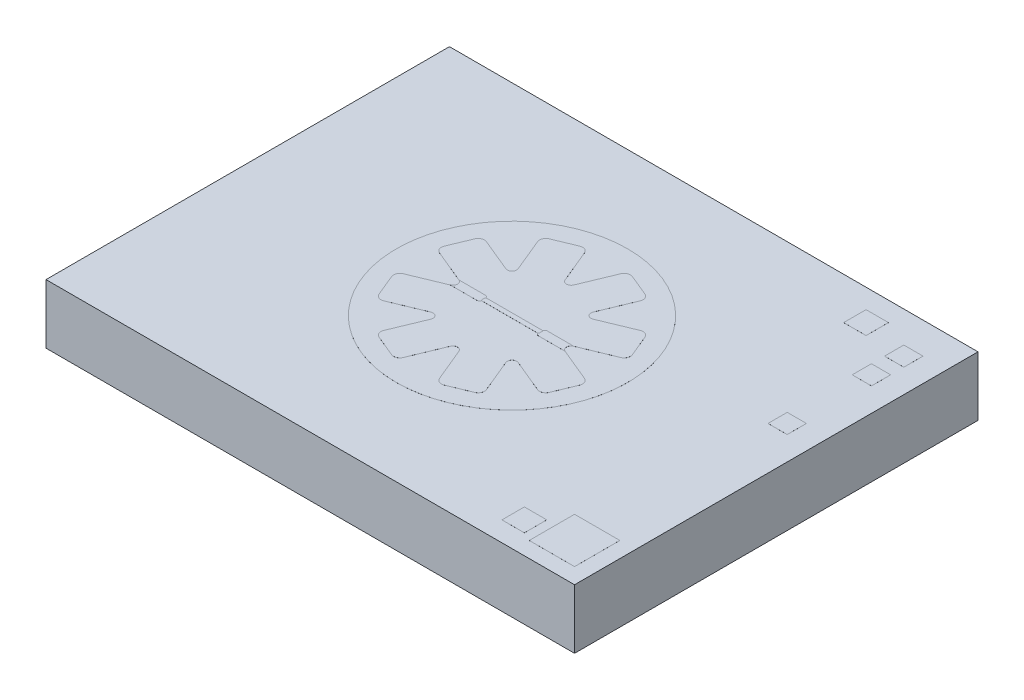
SolidWorks part; units mm, degrees
ref_plane "Front Plane" through (0, 0, 0) normal (0, 0, 1) x (1, 0, 0)
ref_plane "Top Plane" through (0, 0, 0) normal (0, 1, 0) x (1, 0, 0)
ref_plane "Right Plane" through (0, 0, 0) normal (1, 0, 0) x (0, 0, -1)
sketch "Sketch1" plane through (0, 0, 0) normal (0, 1, 0) x (1, 0, 0)
  line L1 (0, 0) -> (4.2926, 0)
  line L2 (0, 0) -> (0, 3.2766)
  line L3 (0, 3.2766) -> (4.2926, 3.2766)
  line L4 (4.2926, 0) -> (4.2926, 3.2766)
  dimension "D1" = 4.2926
  dimension "D2" = 3.2766
extrude "die" add sketch "Sketch1" along normal blind 0.4826
sketch "Sketch2" plane through (0, 0.4826, 0) normal (0, 1, 0) x (1, 0, 0)
  line L0 (0, 3.2766) -> (4.2926, 0) construction
  circle A0 centre (2.1463, 1.6383) radius 0.9398
  dimension "D1" = 1.8796
extrude "Boss-Extrude1" add sketch "Sketch2" along normal blind 0.0003
sketch "Sketch3" plane through (0, 0.4829, 0) normal (0, 1, 0) x (1, 0, 0)
  line L0 (1.7653, 1.6383) -> (1.363, 1.8049)
  line L1 (1.363, 1.8049) -> (1.4746, 2.0743)
  line L2 (1.4746, 2.0743) -> (1.8769, 1.9077)
  line L3 (1.8769, 1.9077) -> (1.7103, 2.31)
  line L4 (1.7103, 2.31) -> (1.9797, 2.4216)
  line L5 (1.9797, 2.4216) -> (2.1463, 2.0193)
  line L6 (1.4188, 1.9396) -> (2.1463, 1.6383) construction
  line L7 (1.845, 2.3658) -> (2.1463, 1.6383) construction
  line L8 (2.5273, 1.6383) -> (1.7653, 1.6383) construction
  line L9 (2.1463, 1.2573) -> (2.1463, 2.0193) construction
  line L10 (2.4476, 2.3658) -> (2.1463, 1.6383) construction
  line L11 (2.8738, 1.9396) -> (2.1463, 1.6383) construction
  line L12 (2.3129, 2.4216) -> (2.1463, 2.0193)
  line L13 (2.5823, 2.31) -> (2.3129, 2.4216)
  line L14 (2.4157, 1.9077) -> (2.5823, 2.31)
  line L15 (2.818, 2.0743) -> (2.4157, 1.9077)
  line L16 (2.9296, 1.8049) -> (2.818, 2.0743)
  line L17 (2.5273, 1.6383) -> (2.9296, 1.8049)
  line L18 (2.8738, 1.337) -> (2.1463, 1.6383) construction
  line L19 (2.4476, 0.9108) -> (2.1463, 1.6383) construction
  line L20 (1.845, 0.9108) -> (2.1463, 1.6383) construction
  line L21 (1.4188, 1.337) -> (2.1463, 1.6383) construction
  line L22 (2.5273, 1.6383) -> (2.9296, 1.4717)
  line L23 (2.9296, 1.4717) -> (2.818, 1.2023)
  line L24 (2.818, 1.2023) -> (2.4157, 1.3689)
  line L25 (2.4157, 1.3689) -> (2.5823, 0.9666)
  line L26 (2.5823, 0.9666) -> (2.3129, 0.855)
  line L27 (2.3129, 0.855) -> (2.1463, 1.2573)
  line L28 (1.9797, 0.855) -> (2.1463, 1.2573)
  line L29 (1.7103, 0.9666) -> (1.9797, 0.855)
  line L30 (1.8769, 1.3689) -> (1.7103, 0.9666)
  line L31 (1.4746, 1.2023) -> (1.8769, 1.3689)
  line L32 (1.363, 1.4717) -> (1.4746, 1.2023)
  line L33 (1.7653, 1.6383) -> (1.363, 1.4717)
  circle A0 centre (2.1463, 1.6383) radius 0.381 construction
  circle A1 centre (2.1463, 1.6383) radius 0.9398 construction
  dimension "D2" = 0.762
  dimension "D1" = 0.7874
  dimension "D3" = 45
extrude "Boss-Extrude2" add sketch "Sketch3" along normal blind 0.0003
fillet "Fillet1" radius 0.0381 8 edges at (1.7653, 0.483, -1.6383) (1.8769, 0.483, -1.3689) (2.1463, 0.483, -1.2573) (2.4157, 0.483, -1.3689) (2.5273, 0.483, -1.6383) (2.4157, 0.483, -1.9077) (2.1463, 0.483, -2.0193) (1.8769, 0.483, -1.9077)
fillet "Fillet2" radius 0.0508 16 edges at (1.9797, 0.483, -0.855) (1.7103, 0.483, -0.9666) (1.4746, 0.483, -1.2023) (1.363, 0.483, -1.4717) (1.363, 0.483, -1.8049) (1.4746, 0.483, -2.0743) (1.7103, 0.483, -2.31) (1.9797, 0.483, -2.4216) (2.3129, 0.483, -2.4216) (2.818, 0.483, -2.0743) (2.5823, 0.483, -2.31) (2.9296, 0.483, -1.8049) (2.9296, 0.483, -1.4717) (2.818, 0.483, -1.2023) (2.5823, 0.483, -0.9666) (2.3129, 0.483, -0.855)
sketch "Sketch4" plane through (0, 0.4831, 0) normal (0, 1, 0) x (1, 0, 0)
  line L0 (1.6803, 1.6031) -> (1.8952, 1.6031)
  line L1 (2.7609, 1.6383) -> (1.3971, 1.6383) construction
  line L2 (1.9177, 1.6256) -> (2.3749, 1.6256)
  line L3 (2.3974, 1.6031) -> (2.6123, 1.6031)
  line L4 (2.3974, 1.6735) -> (2.6123, 1.6735)
  line L5 (1.9177, 1.651) -> (2.3749, 1.651)
  line L6 (1.6803, 1.6735) -> (1.8952, 1.6735)
  arc A0 (1.6803, 1.6031) -> (1.6803, 1.6735) centre (1.6657, 1.6383) ccw construction
  arc A1 (1.6803, 1.6031) -> (1.6803, 1.6735) centre (1.6657, 1.6383) ccw
  arc A2 (2.6123, 1.6735) -> (2.6123, 1.6031) centre (2.6269, 1.6383) ccw construction
  arc A3 (2.6123, 1.6735) -> (2.6123, 1.6031) centre (2.6269, 1.6383) ccw
  arc A4 (1.8952, 1.6031) -> (1.9177, 1.6256) centre (1.8952, 1.6256) ccw
  arc A5 (2.3749, 1.6256) -> (2.3974, 1.6031) centre (2.3974, 1.6256) ccw
  arc A6 (2.3749, 1.651) -> (2.3974, 1.6735) centre (2.3974, 1.651) cw
  arc A7 (1.8952, 1.6735) -> (1.9177, 1.651) centre (1.8952, 1.651) cw
  dimension "D1" = 0.0254
  dimension "D2" = 0.4572
extrude "Boss-Extrude3" add sketch "Sketch4" along normal blind 0.0003
sketch "Sketch5" plane through (0, 0.4831, 0) normal (0, 1, 0) x (1, 0, 0)
  line L0 (1.6803, 1.6735) -> (2.6123, 1.6031) construction
  line L1 (2.3974, 1.6031) -> (2.6123, 1.6031) construction
  line L2 (1.9202, 1.6192) -> (2.3724, 1.6192)
  line L3 (1.9126, 1.6269) -> (1.9126, 1.6497)
  line L4 (1.9202, 1.6573) -> (2.3724, 1.6573)
  line L5 (2.38, 1.6269) -> (2.38, 1.6497)
  line L6 (1.9126, 1.6192) -> (2.38, 1.6573) construction
  line L7 (1.9126, 1.6573) -> (2.38, 1.6192) construction
  arc A0 (2.3724, 1.6192) -> (2.38, 1.6269) centre (2.3724, 1.6269) ccw
  arc A1 (2.3724, 1.6573) -> (2.38, 1.6497) centre (2.3724, 1.6497) cw
  arc A2 (1.9202, 1.6192) -> (1.9126, 1.6269) centre (1.9202, 1.6269) cw
  arc A3 (1.9126, 1.6497) -> (1.9202, 1.6573) centre (1.9202, 1.6497) cw
  point P4 (2.1463, 1.6383)
  point P5 (2.1463, 1.6383)
  dimension "D3" = 0.0076
  dimension "D1" = 0.0381
  dimension "D2" = 0.0051
  dimension "D4" = 0.0051
extrude "Boss-Extrude4" add sketch "Sketch5" along normal blind 0.0005
sketch "Sketch6" plane through (0, 0.4826, 0) normal (0, 1, 0) x (1, 0, 0)
  line L0 (4.2926, 0) -> (4.2926, 3.2766) construction
  line L1 (3.5418, 2.9363) -> (3.7238, 2.9363)
  line L2 (3.5418, 2.9363) -> (3.5418, 3.1183)
  line L3 (3.5418, 3.1183) -> (3.7238, 3.1183)
  line L4 (3.7238, 2.9363) -> (3.7238, 3.1183)
  line L5 (3.5418, 2.9363) -> (3.7238, 3.1183) construction
  line L6 (3.5418, 3.1183) -> (3.7238, 2.9363) construction
  line L7 (3.9438, 2.8668) -> (4.0998, 2.8668)
  line L8 (3.9438, 2.8668) -> (3.9438, 3.0228)
  line L9 (3.9438, 3.0228) -> (4.0998, 3.0228)
  line L10 (4.0998, 2.8668) -> (4.0998, 3.0228)
  line L11 (3.9438, 2.8668) -> (4.0998, 3.0228) construction
  line L12 (3.9438, 3.0228) -> (4.0998, 2.8668) construction
  line L13 (3.9438, 2.6038) -> (4.0998, 2.6038)
  line L14 (3.9438, 2.6038) -> (3.9438, 2.7598)
  line L15 (3.9438, 2.7598) -> (4.0998, 2.7598)
  line L16 (4.0998, 2.6038) -> (4.0998, 2.7598)
  line L17 (3.9438, 2.6038) -> (4.0998, 2.7598) construction
  line L18 (3.9438, 2.7598) -> (4.0998, 2.6038) construction
  line L19 (3.9438, 1.9198) -> (4.0998, 1.9198)
  line L20 (3.9438, 1.9198) -> (3.9438, 2.0758)
  line L21 (3.9438, 2.0758) -> (4.0998, 2.0758)
  line L22 (4.0998, 1.9198) -> (4.0998, 2.0758)
  line L23 (3.9438, 1.9198) -> (4.0998, 2.0758) construction
  line L24 (3.9438, 2.0758) -> (4.0998, 1.9198) construction
  line L25 (3.7973, 0.1273) -> (4.1653, 0.1273)
  line L26 (3.7973, 0.1273) -> (3.7973, 0.4953)
  line L27 (3.7973, 0.4953) -> (4.1653, 0.4953)
  line L28 (4.1653, 0.1273) -> (4.1653, 0.4953)
  line L29 (3.7973, 0.1273) -> (4.1653, 0.4953) construction
  line L30 (3.7973, 0.4953) -> (4.1653, 0.1273) construction
  line L31 (3.5418, 0.1613) -> (3.7238, 0.1613)
  line L32 (3.5418, 0.1613) -> (3.5418, 0.3433)
  line L33 (3.5418, 0.3433) -> (3.7238, 0.3433)
  line L34 (3.7238, 0.1613) -> (3.7238, 0.3433)
  line L35 (3.5418, 0.1613) -> (3.7238, 0.3433) construction
  line L36 (3.5418, 0.3433) -> (3.7238, 0.1613) construction
  line L37 (0, 0) -> (4.2926, 0) construction
  point P0 (3.6328, 3.0273)
  point P5 (4.0218, 2.9448)
  point P10 (4.0218, 2.6818)
  point P15 (4.0218, 1.9978)
  point P20 (3.9813, 0.3113)
  point P25 (3.6328, 0.2523)
  dimension "D1" = 0.156
  dimension "D2" = 0.182
  dimension "D3" = 0.368
  dimension "D4" = 0.182
  dimension "D5" = 0.6598
  dimension "D6" = 0.2523
  dimension "D7" = 0.3113
  dimension "D8" = 0.3113
  dimension "D9" = 1.9978
  dimension "D10" = 0.2708
  dimension "D11" = 2.6818
  dimension "D12" = 2.9448
  dimension "D13" = 3.0273
  dimension "D14" = 0.6598
extrude "top pads" add sketch "Sketch6" along normal blind 0.0003
sketch "Sketch9" plane through (0, 0, 0) normal (0, -1, 0) x (1, 0, 0)
  line L1 (3.7813, -2.7078) -> (3.9083, -2.7078)
  line L2 (3.7813, -2.7078) -> (3.7813, -2.4018)
  line L3 (3.7813, -2.4018) -> (3.9083, -2.4018)
  line L4 (3.9083, -2.7078) -> (3.9083, -2.4018)
  line L5 (3.7813, -2.7078) -> (3.9083, -2.4018) construction
  line L6 (3.7813, -2.4018) -> (3.9083, -2.7078) construction
  line L7 (3.7813, -1.7858) -> (3.9083, -1.7858)
  line L8 (3.7813, -1.7858) -> (3.7813, -1.4798)
  line L9 (3.7813, -1.4798) -> (3.9083, -1.4798)
  line L10 (3.9083, -1.7858) -> (3.9083, -1.4798)
  line L11 (3.7813, -1.7858) -> (3.9083, -1.4798) construction
  line L12 (3.7813, -1.4798) -> (3.9083, -1.7858) construction
  line L13 (3.7813, -0.8778) -> (3.9083, -0.8778)
  line L14 (3.7813, -0.8778) -> (3.7813, -0.5718)
  line L15 (3.7813, -0.5718) -> (3.9083, -0.5718)
  line L16 (3.9083, -0.8778) -> (3.9083, -0.5718)
  line L17 (3.7813, -0.8778) -> (3.9083, -0.5718) construction
  line L18 (3.7813, -0.5718) -> (3.9083, -0.8778) construction
  line L19 (0, 0) -> (4.2926, 0) construction
  line L20 (4.2926, 0) -> (4.2926, -3.2766) construction
  point P0 (3.8448, -2.5548)
  point P5 (3.8448, -1.6328)
  point P10 (3.8448, -0.7248)
  dimension "D1" = 0.7248
  dimension "D2" = 1.6328
  dimension "D3" = 2.5548
  dimension "D4" = 0.4478
  dimension "D5" = 0.306
  dimension "D6" = 0.127
extrude "bottom pads" add sketch "Sketch9" along normal blind 0.0005
sketch "Sketch7" plane through (0, 0, 0) normal (0, -1, 0) x (1, 0, 0)
  line L0 (3.921, -2.7078) -> (1.5677, -2.7078)
  line L1 (1.5677, -2.7078) -> (1.5677, -1.6535)
  line L2 (1.5677, -1.6535) -> (2.3358, -1.6535)
  line L3 (2.3358, -1.6535) -> (2.3358, -2.4018)
  line L4 (2.3358, -2.4018) -> (3.921, -2.4018)
  line L5 (3.921, -2.4018) -> (3.921, -2.7078)
  line L6 (3.9083, -2.7078) -> (3.9083, -2.4018) construction
  line L10 (0, -1.6383) -> (3.5182, -1.6383) construction
  line L11 (0, -3.2766) -> (0, 0) construction
  line L12 (3.921, -0.8748) -> (3.921, -0.5688)
  line L13 (2.3358, -0.8748) -> (3.921, -0.8748)
  line L14 (2.3358, -1.6231) -> (2.3358, -0.8748)
  line L15 (1.5677, -1.6231) -> (2.3358, -1.6231)
  line L16 (1.5677, -0.5688) -> (1.5677, -1.6231)
  line L17 (3.921, -0.5688) -> (1.5677, -0.5688)
  line L18 (2.399, -1.7858) -> (3.921, -1.7858)
  line L19 (3.921, -1.7858) -> (3.921, -1.4798)
  line L20 (3.921, -1.4798) -> (2.399, -1.4798)
  line L21 (2.399, -1.4798) -> (2.399, -1.7858)
  line L25 (3.7813, -2.7078) -> (3.9083, -2.7078) construction
  line L26 (3.9083, -2.4018) -> (3.7813, -2.4018) construction
  line L28 (3.7813, -1.7858) -> (3.9083, -1.7858) construction
  line L29 (3.9083, -1.4798) -> (3.7813, -1.4798) construction
  dimension "D1" = 2.3533
  dimension "D2" = 0.7681
  dimension "D3" = 0.0127
  dimension "D4" = 0.0152
  dimension "D5" = 0.0632
extrude "bottom metal" add sketch "Sketch7" along normal blind 0.0003
sketch "Sketch8" plane through (0, -0.0003, 0) normal (0, -1, 0) x (1, 0, 0)
  line L1 (1.5677, -1.6535) -> (1.5677, -2.7078) construction
  line L2 (1.6109, -1.6967) -> (2.2926, -1.6967)
  line L3 (1.6109, -1.6967) -> (1.6109, -2.3785)
  line L4 (1.6109, -2.3785) -> (2.2926, -2.3785)
  line L5 (0, -1.6383) -> (2.9386, -1.6383) construction
  line L6 (0, -3.2766) -> (0, 0) construction
  line L7 (2.2926, -1.6967) -> (2.2926, -2.3785)
  line L8 (2.3358, -1.6535) -> (1.5677, -1.6535) construction
  line L9 (2.3358, -2.4018) -> (2.3358, -1.6535) construction
  line L10 (2.2926, -1.5799) -> (2.2926, -0.8981)
  line L12 (1.6109, -0.8981) -> (2.2926, -0.8981)
  line L13 (1.6109, -1.5799) -> (1.6109, -0.8981)
  line L14 (1.6109, -1.5799) -> (2.2926, -1.5799)
extrude "KOH etch" cut sketch "Sketch8" against normal offset from surface 0.005 draft 35.3
sketch "Sketch18" plane through (0, -0.0003, 0) normal (0, -1, 0) x (1, 0, 0)
  line L0 (3.921, -1.4798) -> (3.9083, -1.4798) construction
  line L1 (2.399, -1.7858) -> (2.526, -1.7858)
  line L2 (2.399, -1.7858) -> (2.399, -1.4798)
  line L3 (2.399, -1.4798) -> (2.526, -1.4798)
  line L4 (2.526, -1.7858) -> (2.526, -1.4798)
  dimension "D1" = 0.127
extrude "Cut-Extrude1" cut sketch "Sketch18" against normal blind 0.0254 draft 35.3
sketch "Sketch19" plane through (0, 0.4826, 0) normal (0, 1, 0) x (1, 0, 0)
  line L0 (4.2926, 3.2766) -> (0, 3.2766) construction
  line L1 (0.508, 3.0226) -> (2.0701, 3.0226)
  line L2 (0.254, 2.7686) -> (0.254, 0.508)
  line L3 (0.508, 0.254) -> (2.0701, 0.254)
  line L4 (3.3401, 1.7526) -> (3.3401, 1.524)
  line L5 (0, 0) -> (4.2926, 0) construction
  line L6 (0, 3.2766) -> (0, 0) construction
  arc A0 (0.254, 0.508) -> (0.508, 0.254) centre (0.508, 0.508) ccw
  arc A1 (0.508, 3.0226) -> (0.254, 2.7686) centre (0.508, 2.7686) ccw
  arc A2 (2.0701, 0.254) -> (3.3401, 1.524) centre (2.0701, 1.524) ccw
  arc A3 (2.0701, 3.0226) -> (3.3401, 1.7526) centre (2.0701, 1.7526) cw
  circle A5 centre (2.1463, 1.6383) radius 0.9398 construction
  dimension "D1" = 0.254
  dimension "D2" = 1.27
  dimension "D3" = 0.254
  dimension "D4" = 0.254
  dimension "D5" = 0.254
  dimension "D6" = 0.254
extrude "Boss-Extrude5" [suppressed] add sketch "Sketch19" along normal blind 0.0254 separate body
